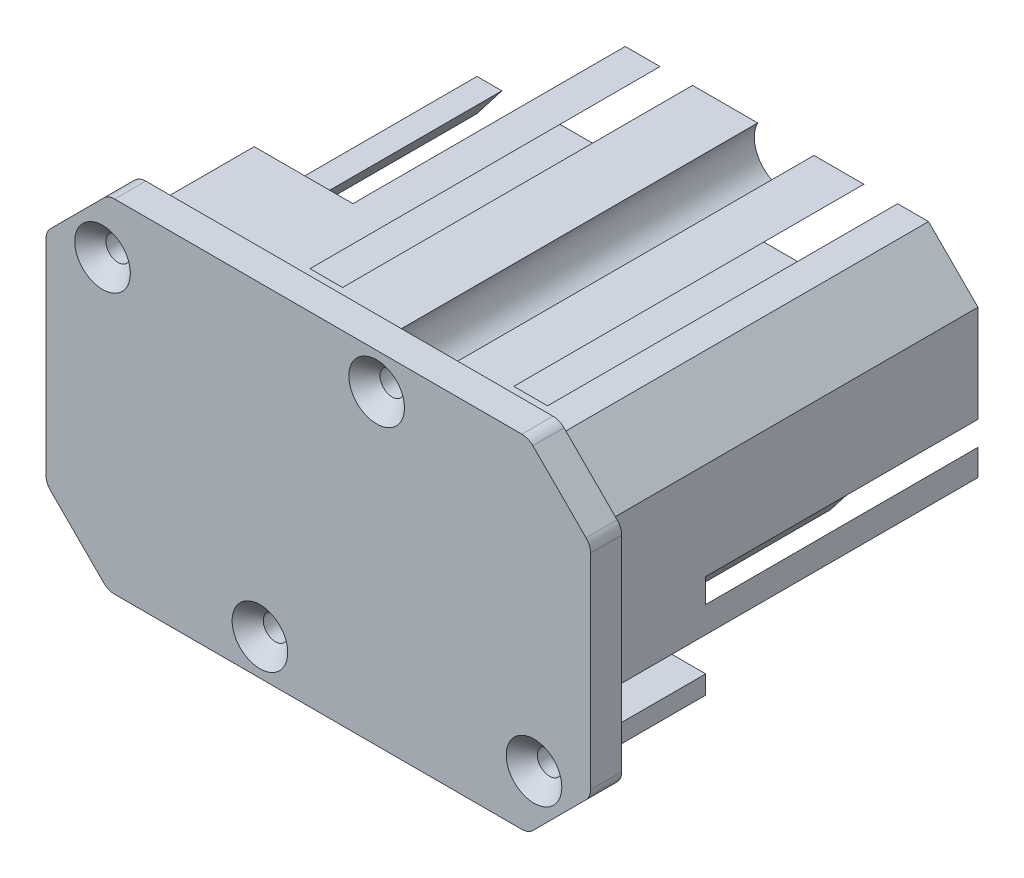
SolidWorks part; units mm, degrees
ref_plane "Front Plane" through (0, 0, 0) normal (0, 0, 1) x (1, 0, 0)
ref_plane "Top Plane" through (0, 0, 0) normal (0, 1, 0) x (1, 0, 0)
ref_plane "Right Plane" through (0, 0, 0) normal (1, 0, 0) x (0, 0, -1)
sketch "Sketch1" plane through (0, 0, 0) normal (0, 0, 1) x (1, 0, 0)
  line L1 (-35, 22) -> (35, 22)
  line L2 (-35, 22) -> (-35, -22)
  line L3 (-35, -22) -> (35, -22)
  line L4 (35, 22) -> (35, -22)
  circle A1 centre (-27.7296, 14.7296) radius 1.575
  circle A2 centre (7.5, 17.375) radius 1.575
  circle A3 centre (27.7296, -14.7296) radius 1.575
  circle A4 centre (-7.5, -17.375) radius 1.575
  dimension "D3" = 3.15
  dimension "D1" = 44
  dimension "D2" = 70
extrude "Boss-Extrude1" add sketch "Sketch1" along normal blind 4
chamfer "Chamfer1" distance 8 angle 45 4 edges at (35, 22, 2) (-35, 22, 2) (35, -22, 2) (-35, -22, 2)
sketch "Sketch3" plane through (0, 0, 0) normal (0, 0, -1) x (-1, 0, 0)
  line L0 (-32.5, -12.9645) -> (-31.4171, -14.0474)
  line L1 (-32.5, -12.9645) -> (-32.5, 12.9645)
  line L2 (-32.5, 12.9645) -> (-25.9645, 19.5)
  line L3 (-25.9645, 19.5) -> (-10.5898, 19.5)
  line L4 (25.9645, 19.5) -> (27.0474, 18.4171)
  line L5 (32.5, 12.9645) -> (32.5, -12.9645)
  line L6 (32.5, -12.9645) -> (25.9645, -19.5)
  line L7 (25.9645, -19.5) -> (10.5898, -19.5)
  line L8 (-27.0474, -18.4171) -> (-25.9645, -19.5)
  line L9 (-4.4102, 19.5) -> (25.9645, 19.5)
  line L10 (4.4102, -19.5) -> (-25.9645, -19.5)
  line L11 (31.4171, 14.0474) -> (32.5, 12.9645)
  line L12 (-32.2, 12.8402) -> (-25.8402, 19.2)
  line L13 (-25.8402, 19.2) -> (-11.1155, 19.2)
  line L14 (-3.8845, 19.2) -> (25.8402, 19.2)
  line L15 (25.8402, 19.2) -> (26.4636, 18.5766)
  line L16 (31.5766, 13.4636) -> (32.2, 12.8402)
  line L17 (32.2, 12.8402) -> (32.2, -12.8402)
  line L18 (32.2, -12.8402) -> (25.8402, -19.2)
  line L19 (25.8402, -19.2) -> (11.1155, -19.2)
  line L20 (3.8845, -19.2) -> (-25.8402, -19.2)
  line L21 (-26.4636, -18.5766) -> (-25.8402, -19.2)
  line L22 (-32.2, -12.8402) -> (-31.5766, -13.4636)
  line L23 (-32.2, -12.8402) -> (-32.2, 12.8402)
  line L24 (-25.8402, 15.1483) -> (-25.8402, 1.8227)
  line L25 (-25.8402, 1.8227) -> (-16.4121, 1.8227)
  line L26 (-12.6841, 1.8227) -> (-12.6841, 6.3365)
  line L27 (-12.6841, 6.3365) -> (0.5794, 6.3365)
  line L28 (0.5794, 6.3365) -> (0.5794, 1.8227)
  line L29 (0.5794, 1.8227) -> (9.3482, 1.8227)
  line L30 (14.1207, 1.8227) -> (14.1207, 6.3365)
  line L31 (14.1207, 6.3365) -> (32.2, 6.3365)
  line L32 (32.2, 9.863) -> (20.194, 10.8438)
  line L33 (20.194, 10.8438) -> (13.4919, 10.8438)
  line L34 (13.4919, 10.8438) -> (13.4919, 15.1483)
  line L35 (13.4919, 15.1483) -> (0.5794, 15.1483)
  line L36 (0.5794, 15.1483) -> (0.5794, 10.8438)
  line L37 (0.5794, 10.8438) -> (-12.9503, 10.8438)
  line L38 (-12.9503, 10.8438) -> (-12.9503, 15.1483)
  line L39 (-12.9503, 15.1483) -> (-25.8402, 15.1483)
  line L40 (-13.4605, -6.1166) -> (-32.2, -6.1166)
  line L41 (-13.4605, -6.1166) -> (-13.4605, -1.2599)
  line L42 (-9.1598, -1.2599) -> (0, -1.2599)
  line L43 (0, -1.2599) -> (0, -5.7381)
  line L44 (0, -5.7381) -> (13.0935, -5.7381)
  line L45 (13.0935, -5.7381) -> (13.4919, -1.7014)
  line L46 (17.6448, -1.7014) -> (27.0474, -1.7014)
  line L47 (27.0474, -1.7014) -> (27.0474, -15.1361)
  line L48 (27.0474, -15.1361) -> (13.0935, -15.1361)
  line L49 (13.0935, -15.1361) -> (13.0935, -10.4687)
  line L50 (13.0935, -10.4687) -> (0, -10.4687)
  line L51 (0, -10.4687) -> (0, -15.1361)
  line L52 (0, -15.1361) -> (-13.4605, -15.1361)
  line L53 (-13.4605, -15.1361) -> (-13.4605, -10.4687)
  line L54 (-13.4605, -10.4687) -> (-32.2, -10.4687)
  line L55 (-16.4121, 1.8227) -> (-13.4605, -1.2599)
  line L56 (-12.6841, 1.8227) -> (-9.1598, -1.2599)
  line L57 (14.1207, 1.8227) -> (17.6448, -1.7014)
  line L58 (9.3482, 1.8227) -> (13.4919, -1.7014)
  arc A0 (-27.0474, -18.4171) -> (-31.4171, -14.0474) centre (-27.7296, -14.7296) ccw
  arc A1 (-10.5898, 19.5) -> (-4.4102, 19.5) centre (-7.5, 17.375) ccw
  arc A2 (27.0474, 18.4171) -> (31.4171, 14.0474) centre (27.7296, 14.7296) ccw
  arc A3 (10.5898, -19.5) -> (4.4102, -19.5) centre (7.5, -17.375) ccw
  arc A4 (-11.1155, 19.2) -> (-3.8845, 19.2) centre (-7.5, 17.375) ccw
  arc A5 (26.4636, 18.5766) -> (31.5766, 13.4636) centre (27.7296, 14.7296) ccw
  arc A6 (11.1155, -19.2) -> (3.8845, -19.2) centre (7.5, -17.375) ccw
  arc A7 (-26.4636, -18.5766) -> (-31.5766, -13.4636) centre (-27.7296, -14.7296) ccw
  dimension "D1" = 0.3
extrude "Boss-Extrude2" add sketch "Sketch3" along normal blind 3.6 contours A5 L15 L14 A4 L13 L12 L23 L40 L41 L55 L25 L24 L39 L38 L37 L36 L35 L34 L33 L32 L17 L16 | A7 L21 L20 A6 L19 L18 L17 L31 L30 L57 L46 L47 L48 L49 L50 L51 L52 L53 L54 L23 L22 | L58 L29 L28 L27 L26 L56 L42 L43 L44 L45
fillet "Fillet1" radius 2 8 edges at (-27, -22, 2) (-35, -14, 2) (-35, 14, 2) (-27, 22, 2) (27, 22, 2) (35, 14, 2) (27, -22, 2) (35, -14, 2)
chamfer "Chamfer2" distance 2 angle 45 4 edges at (29.3046, -14.7296, 4) (-26.1546, 14.7296, 4) (9.075, 17.375, 4) (-5.925, -17.375, 4)
sketch "Sketch5" plane through (0, 0, -3.6) normal (0, 0, -1) x (-1, 0, 0)
  line L0 (13.4919, -1.7014) -> (9.3482, 1.8227) construction
  line L1 (9.3482, 1.8227) -> (0.5794, 1.8227) construction
  line L2 (0.5794, 1.8227) -> (0.5794, 6.3365) construction
  line L3 (0.5794, 6.3365) -> (-12.6841, 6.3365) construction
  line L4 (-12.6841, 6.3365) -> (-12.6841, 1.8227) construction
  line L5 (-12.6841, 1.8227) -> (-9.1598, -1.2599) construction
  line L6 (-9.1598, -1.2599) -> (0, -1.2599) construction
  line L7 (0, -1.2599) -> (0, -5.7381) construction
  line L8 (0, -5.7381) -> (13.0935, -5.7381) construction
  line L9 (13.0935, -5.7381) -> (13.4919, -1.7014) construction
  line L10 (-26.4636, -18.5766) -> (-25.8402, -19.2) construction
  line L11 (-25.8402, -19.2) -> (3.8845, -19.2) construction
  line L12 (11.1155, -19.2) -> (25.8402, -19.2) construction
  line L13 (25.8402, -19.2) -> (32.2, -12.8402) construction
  line L14 (32.2, -12.8402) -> (32.2, 6.3365) construction
  line L15 (32.2, 6.3365) -> (14.1207, 6.3365) construction
  line L16 (14.1207, 6.3365) -> (14.1207, 1.8227) construction
  line L17 (14.1207, 1.8227) -> (17.6448, -1.7014) construction
  line L18 (17.6448, -1.7014) -> (27.0474, -1.7014) construction
  line L19 (27.0474, -1.7014) -> (27.0474, -15.1361) construction
  line L20 (27.0474, -15.1361) -> (13.0935, -15.1361) construction
  line L21 (13.0935, -15.1361) -> (13.0935, -10.4687) construction
  line L22 (13.0935, -10.4687) -> (0, -10.4687) construction
  line L23 (0, -10.4687) -> (0, -15.1361) construction
  line L24 (0, -15.1361) -> (-13.4605, -15.1361) construction
  line L25 (-13.4605, -15.1361) -> (-13.4605, -10.4687) construction
  line L26 (-13.4605, -10.4687) -> (-32.2, -10.4687) construction
  line L27 (-32.2, -10.4687) -> (-32.2, -12.8402) construction
  line L28 (-32.2, -12.8402) -> (-31.5766, -13.4636) construction
  line L29 (26.4636, 18.5766) -> (25.8402, 19.2) construction
  line L30 (25.8402, 19.2) -> (-3.8845, 19.2) construction
  line L31 (-11.1155, 19.2) -> (-25.8402, 19.2) construction
  line L32 (-25.8402, 19.2) -> (-32.2, 12.8402) construction
  line L33 (-32.2, 12.8402) -> (-32.2, -6.1166) construction
  line L34 (-32.2, -6.1166) -> (-13.4605, -6.1166) construction
  line L35 (-13.4605, -6.1166) -> (-13.4605, -1.2599) construction
  line L36 (-13.4605, -1.2599) -> (-16.4121, 1.8227) construction
  line L37 (-16.4121, 1.8227) -> (-25.8402, 1.8227) construction
  line L38 (-25.8402, 1.8227) -> (-25.8402, 15.1483) construction
  line L39 (-25.8402, 15.1483) -> (-12.9503, 15.1483) construction
  line L40 (-12.9503, 15.1483) -> (-12.9503, 10.8438) construction
  line L41 (-12.9503, 10.8438) -> (0.5794, 10.8438) construction
  line L42 (0.5794, 10.8438) -> (0.5794, 15.1483) construction
  line L43 (0.5794, 15.1483) -> (13.4919, 15.1483) construction
  line L44 (13.4919, 15.1483) -> (13.4919, 10.8438) construction
  line L45 (13.4919, 10.8438) -> (20.194, 10.8438) construction
  line L46 (20.194, 10.8438) -> (32.2, 9.863) construction
  line L47 (32.2, 9.863) -> (32.2, 12.8402) construction
  line L48 (32.2, 12.8402) -> (31.5766, 13.4636) construction
  line L49 (13.4919, -1.7014) -> (9.3482, 1.8227)
  line L50 (9.3482, 1.8227) -> (0.5794, 1.8227)
  line L51 (0.5794, 1.8227) -> (0.5794, 6.3365)
  line L52 (0.5794, 6.3365) -> (-12.6841, 6.3365)
  line L53 (-12.6841, 6.3365) -> (-12.6841, 1.8227)
  line L54 (-12.6841, 1.8227) -> (-9.1598, -1.2599)
  line L55 (-9.1598, -1.2599) -> (0, -1.2599)
  line L56 (0, -1.2599) -> (0, -5.7381)
  line L57 (0, -5.7381) -> (13.0935, -5.7381)
  line L58 (13.0935, -5.7381) -> (13.4919, -1.7014)
  line L59 (-26.4636, -18.5766) -> (-25.8402, -19.2)
  line L60 (-25.8402, -19.2) -> (3.8845, -19.2)
  line L61 (11.1155, -19.2) -> (25.8402, -19.2)
  line L62 (25.8402, -19.2) -> (32.2, -12.8402)
  line L63 (32.2, -12.8402) -> (32.2, 6.3365)
  line L64 (32.2, 6.3365) -> (14.1207, 6.3365)
  line L65 (14.1207, 6.3365) -> (14.1207, 1.8227)
  line L66 (14.1207, 1.8227) -> (17.6448, -1.7014)
  line L67 (17.6448, -1.7014) -> (27.0474, -1.7014)
  line L68 (27.0474, -1.7014) -> (27.0474, -15.1361)
  line L69 (27.0474, -15.1361) -> (13.0935, -15.1361)
  line L70 (13.0935, -15.1361) -> (13.0935, -10.4687)
  line L71 (13.0935, -10.4687) -> (0, -10.4687)
  line L72 (0, -10.4687) -> (0, -15.1361)
  line L73 (0, -15.1361) -> (-13.4605, -15.1361)
  line L74 (-13.4605, -15.1361) -> (-13.4605, -10.4687)
  line L75 (-13.4605, -10.4687) -> (-32.2, -10.4687)
  line L76 (-32.2, -10.4687) -> (-32.2, -12.8402)
  line L77 (-32.2, -12.8402) -> (-31.5766, -13.4636)
  line L78 (26.4636, 18.5766) -> (25.8402, 19.2)
  line L79 (25.8402, 19.2) -> (-3.8845, 19.2)
  line L80 (-11.1155, 19.2) -> (-25.8402, 19.2)
  line L81 (-25.8402, 19.2) -> (-32.2, 12.8402)
  line L82 (-32.2, 12.8402) -> (-32.2, -6.1166)
  line L83 (-32.2, -6.1166) -> (-13.4605, -6.1166)
  line L84 (-13.4605, -6.1166) -> (-13.4605, -1.2599)
  line L85 (-13.4605, -1.2599) -> (-16.4121, 1.8227)
  line L86 (-16.4121, 1.8227) -> (-25.8402, 1.8227)
  line L87 (-25.8402, 1.8227) -> (-25.8402, 15.1483)
  line L88 (-25.8402, 15.1483) -> (-12.9503, 15.1483)
  line L89 (-12.9503, 15.1483) -> (-12.9503, 10.8438)
  line L90 (-12.9503, 10.8438) -> (0.5794, 10.8438)
  line L91 (0.5794, 10.8438) -> (0.5794, 15.1483)
  line L92 (0.5794, 15.1483) -> (13.4919, 15.1483)
  line L93 (13.4919, 15.1483) -> (13.4919, 10.8438)
  line L94 (13.4919, 10.8438) -> (20.194, 10.8438)
  line L95 (20.194, 10.8438) -> (32.2, 9.863)
  line L96 (32.2, 9.863) -> (32.2, 12.8402)
  line L97 (32.2, 12.8402) -> (31.5766, 13.4636)
  arc A0 (-26.4636, -18.5766) -> (-31.5766, -13.4636) centre (-27.7296, -14.7296) ccw construction
  arc A1 (11.1155, -19.2) -> (3.8845, -19.2) centre (7.5, -17.375) ccw construction
  arc A2 (26.4636, 18.5766) -> (31.5766, 13.4636) centre (27.7296, 14.7296) ccw construction
  arc A3 (-11.1155, 19.2) -> (-3.8845, 19.2) centre (-7.5, 17.375) ccw construction
  arc A4 (-26.4636, -18.5766) -> (-31.5766, -13.4636) centre (-27.7296, -14.7296) ccw
  arc A5 (11.1155, -19.2) -> (3.8845, -19.2) centre (7.5, -17.375) ccw
  arc A6 (26.4636, 18.5766) -> (31.5766, 13.4636) centre (27.7296, 14.7296) ccw
  arc A7 (-11.1155, 19.2) -> (-3.8845, 19.2) centre (-7.5, 17.375) ccw
  circle A8 centre (19.5955, -8.5953) radius 10.8193
  circle A9 centre (6.5774, 8.554) radius 10.85
  circle A10 centre (-6.4589, -8.6094) radius 10.8266
  circle A11 centre (-19.6973, 8.5839) radius 10.8354
extrude "Boss-Extrude3" add sketch "Sketch5" along normal blind 10 contours A9 A8 M27 M28 M29 M30 | A9 L94 L95 L96 L97 A6 L78 L79 | A11 A7 L80 | A8 M26 M27 | A11 L80 L81 L82 L83 A10 L85 | A10 L75 M42 M43 M23 M24 M25 | A11 L54 A10 A9 L52 | A10 L57 A8 A9
sketch "Sketch6" plane through (0, 0, -13.6) normal (0, 0, -1) x (-1, 0, 0)
  line L15 (21.7397, -19.2) -> (25.8402, -19.2) construction
  line L17 (32.2, -12.8402) -> (32.2, 6.3365) construction
  line L42 (21.7397, -19.2) -> (25.8402, -19.2)
  line L54 (19.0691, 19.2) -> (32.2, 2.1927)
  line L56 (23.1123, 6.3365) -> (32.2, -5.0443)
  line L57 (-18.7302, -19.2) -> (-32.2, -2.745)
  line L58 (-32.2, 0.3674) -> (-29.6104, 2.0693)
  line L59 (-23.2137, -6.1166) -> (-29.6104, 2.0693)
  line L60 (-19.9992, -10.4687) -> (-13.2212, -19.2)
  line L61 (19.6039, 10.8438) -> (13.1459, 19.2)
  line L62 (17.183, 10.8438) -> (20.194, 10.8438) construction
  line L63 (20.194, 10.8438) -> (32.2, 9.863) construction
  line L64 (32.2, 9.863) -> (32.2, 12.8402) construction
  line L65 (32.2, 12.8402) -> (31.5766, 13.4636) construction
  line L66 (26.4636, 18.5766) -> (25.8402, 19.2) construction
  line L67 (25.8402, 19.2) -> (8.6713, 19.2) construction
  line L68 (14.6448, 1.2986) -> (14.827, 1.1164) construction
  line L69 (25.8402, -19.2) -> (32.2, -12.8402) construction
  line L70 (32.2, 6.3365) -> (17.1984, 6.3365) construction
  line L71 (-9.1003, 10.8438) -> (-4.0282, 10.8438) construction
  line L72 (4.4836, 19.2) -> (-3.8845, 19.2) construction
  line L73 (-11.1155, 19.2) -> (-17.5285, 19.2) construction
  line L74 (-11.86, 1.1019) -> (-11.6312, 0.9018) construction
  line L75 (-4.0435, 6.3365) -> (-9.0976, 6.3365) construction
  line L76 (3.9801, -5.7381) -> (9.1603, -5.7381) construction
  line L77 (-4.2103, -19.2) -> (3.8845, -19.2) construction
  line L78 (11.1155, -19.2) -> (17.4513, -19.2) construction
  line L79 (8.9396, -10.4687) -> (4.2069, -10.4687) construction
  line L80 (-17.1247, -10.4687) -> (-32.2, -10.4687) construction
  line L81 (-32.2, -10.4687) -> (-32.2, -12.8402) construction
  line L82 (-32.2, -12.8402) -> (-31.5766, -13.4636) construction
  line L83 (-26.4636, -18.5766) -> (-25.8402, -19.2) construction
  line L84 (-25.8402, -19.2) -> (-8.7074, -19.2) construction
  line L85 (-21.8661, 19.2) -> (-25.8402, 19.2) construction
  line L86 (-25.8402, 19.2) -> (-32.2, 12.8402) construction
  line L87 (-32.2, 12.8402) -> (-32.2, -6.1166) construction
  line L88 (-32.2, -6.1166) -> (-16.9946, -6.1166) construction
  line L89 (-13.9279, -0.7717) -> (-14.0384, -0.6563) construction
  line L90 (17.183, 10.8438) -> (20.194, 10.8438)
  line L91 (20.194, 10.8438) -> (32.2, 9.863)
  line L92 (32.2, 9.863) -> (32.2, 12.8402)
  line L93 (32.2, 12.8402) -> (31.5766, 13.4636)
  line L94 (26.4636, 18.5766) -> (25.8402, 19.2)
  line L95 (25.8402, 19.2) -> (8.6713, 19.2)
  line L96 (14.6448, 1.2986) -> (14.827, 1.1164)
  line L97 (21.7397, -19.2) -> (25.8402, -19.2)
  line L98 (25.8402, -19.2) -> (32.2, -12.8402)
  line L99 (32.2, -12.8402) -> (32.2, 6.3365)
  line L100 (32.2, 6.3365) -> (17.1984, 6.3365)
  line L101 (-9.1003, 10.8438) -> (-4.0282, 10.8438)
  line L102 (4.4836, 19.2) -> (-3.8845, 19.2)
  line L103 (-11.1155, 19.2) -> (-17.5285, 19.2)
  line L104 (-11.86, 1.1019) -> (-11.6312, 0.9018)
  line L105 (-4.0435, 6.3365) -> (-9.0976, 6.3365)
  line L106 (3.9801, -5.7381) -> (9.1603, -5.7381)
  line L107 (-4.2103, -19.2) -> (3.8845, -19.2)
  line L108 (11.1155, -19.2) -> (17.4513, -19.2)
  line L109 (8.9396, -10.4687) -> (4.2069, -10.4687)
  line L110 (-17.1247, -10.4687) -> (-32.2, -10.4687)
  line L111 (-32.2, -10.4687) -> (-32.2, -12.8402)
  line L112 (-32.2, -12.8402) -> (-31.5766, -13.4636)
  line L113 (-26.4636, -18.5766) -> (-25.8402, -19.2)
  line L114 (-25.8402, -19.2) -> (-8.7074, -19.2)
  line L115 (-21.8661, 19.2) -> (-25.8402, 19.2)
  line L116 (-25.8402, 19.2) -> (-32.2, 12.8402)
  line L117 (-32.2, 12.8402) -> (-32.2, -6.1166)
  line L118 (-32.2, -6.1166) -> (-16.9946, -6.1166)
  line L119 (-13.9279, -0.7717) -> (-14.0384, -0.6563)
  arc A48 (17.183, 10.8438) -> (8.6713, 19.2) centre (6.5774, 8.554) ccw construction
  arc A49 (26.4636, 18.5766) -> (31.5766, 13.4636) centre (27.7296, 14.7296) ccw construction
  arc A50 (14.6448, 1.2986) -> (17.1984, 6.3365) centre (6.5774, 8.554) ccw construction
  arc A51 (21.7397, -19.2) -> (14.827, 1.1164) centre (19.5955, -8.5953) ccw construction
  arc A52 (-9.1003, 10.8438) -> (-17.5285, 19.2) centre (-19.6973, 8.5839) ccw construction
  arc A53 (4.4836, 19.2) -> (-4.0282, 10.8438) centre (6.5774, 8.554) ccw construction
  arc A54 (-11.1155, 19.2) -> (-3.8845, 19.2) centre (-7.5, 17.375) ccw construction
  arc A55 (-11.86, 1.1019) -> (-9.0976, 6.3365) centre (-19.6973, 8.5839) ccw construction
  arc A56 (-0.8686, 0.6623) -> (-11.6312, 0.9018) centre (-6.4589, -8.6094) ccw construction
  arc A57 (-4.0435, 6.3365) -> (-0.8686, 0.6623) centre (6.5774, 8.554) ccw construction
  arc A58 (3.9801, -5.7381) -> (0.973, -0.7364) centre (-6.4589, -8.6094) ccw construction
  arc A59 (12.1212, -0.7728) -> (9.1603, -5.7381) centre (19.5955, -8.5953) ccw construction
  arc A60 (0.973, -0.7364) -> (12.1212, -0.7728) centre (6.5774, 8.554) ccw construction
  arc A61 (-4.2103, -19.2) -> (4.2069, -10.4687) centre (-6.4589, -8.6094) ccw construction
  arc A62 (11.1155, -19.2) -> (3.8845, -19.2) centre (7.5, -17.375) ccw construction
  arc A63 (8.9396, -10.4687) -> (17.4513, -19.2) centre (19.5955, -8.5953) ccw construction
  arc A64 (-17.1247, -10.4687) -> (-8.7074, -19.2) centre (-6.4589, -8.6094) ccw construction
  arc A65 (-26.4636, -18.5766) -> (-31.5766, -13.4636) centre (-27.7296, -14.7296) ccw construction
  arc A66 (-21.8661, 19.2) -> (-14.0384, -0.6563) centre (-19.6973, 8.5839) ccw construction
  arc A67 (-13.9279, -0.7717) -> (-16.9946, -6.1166) centre (-6.4589, -8.6094) ccw construction
  arc A68 (17.183, 10.8438) -> (8.6713, 19.2) centre (6.5774, 8.554) ccw
  arc A69 (26.4636, 18.5766) -> (31.5766, 13.4636) centre (27.7296, 14.7296) ccw
  arc A70 (14.6448, 1.2986) -> (17.1984, 6.3365) centre (6.5774, 8.554) ccw
  arc A71 (21.7397, -19.2) -> (14.827, 1.1164) centre (19.5955, -8.5953) ccw
  arc A72 (-9.1003, 10.8438) -> (-17.5285, 19.2) centre (-19.6973, 8.5839) ccw
  arc A73 (4.4836, 19.2) -> (-4.0282, 10.8438) centre (6.5774, 8.554) ccw
  arc A74 (-11.1155, 19.2) -> (-3.8845, 19.2) centre (-7.5, 17.375) ccw
  arc A75 (-11.86, 1.1019) -> (-9.0976, 6.3365) centre (-19.6973, 8.5839) ccw
  arc A76 (-0.8686, 0.6623) -> (-11.6312, 0.9018) centre (-6.4589, -8.6094) ccw
  arc A77 (-4.0435, 6.3365) -> (-0.8686, 0.6623) centre (6.5774, 8.554) ccw
  arc A78 (3.9801, -5.7381) -> (0.973, -0.7364) centre (-6.4589, -8.6094) ccw
  arc A79 (12.1212, -0.7728) -> (9.1603, -5.7381) centre (19.5955, -8.5953) ccw
  arc A80 (0.973, -0.7364) -> (12.1212, -0.7728) centre (6.5774, 8.554) ccw
  arc A81 (-4.2103, -19.2) -> (4.2069, -10.4687) centre (-6.4589, -8.6094) ccw
  arc A82 (11.1155, -19.2) -> (3.8845, -19.2) centre (7.5, -17.375) ccw
  arc A83 (8.9396, -10.4687) -> (17.4513, -19.2) centre (19.5955, -8.5953) ccw
  arc A84 (-17.1247, -10.4687) -> (-8.7074, -19.2) centre (-6.4589, -8.6094) ccw
  arc A85 (-26.4636, -18.5766) -> (-31.5766, -13.4636) centre (-27.7296, -14.7296) ccw
  arc A86 (-21.8661, 19.2) -> (-14.0384, -0.6563) centre (-19.6973, 8.5839) ccw
  arc A87 (-13.9279, -0.7717) -> (-16.9946, -6.1166) centre (-6.4589, -8.6094) ccw
extrude "Boss-Extrude4" add sketch "Sketch6" along normal blind 35
sketch "Sketch7" plane through (0, 0, -48.6) normal (0, 0, -1) x (-1, 0, 0)
  line L0 (24.47, 7.8783) -> (18.9905, -4.2412)
  line L1 (18.9905, -4.2412) -> (22.8311, -5.9776)
  line L2 (22.8311, -5.9776) -> (29.3202, 8.3748)
  line L3 (29.3202, 8.3748) -> (24.47, 7.8783)
extrude "Cut-Extrude1" cut sketch "Sketch7" against normal up to surface (48.6 mm away)
